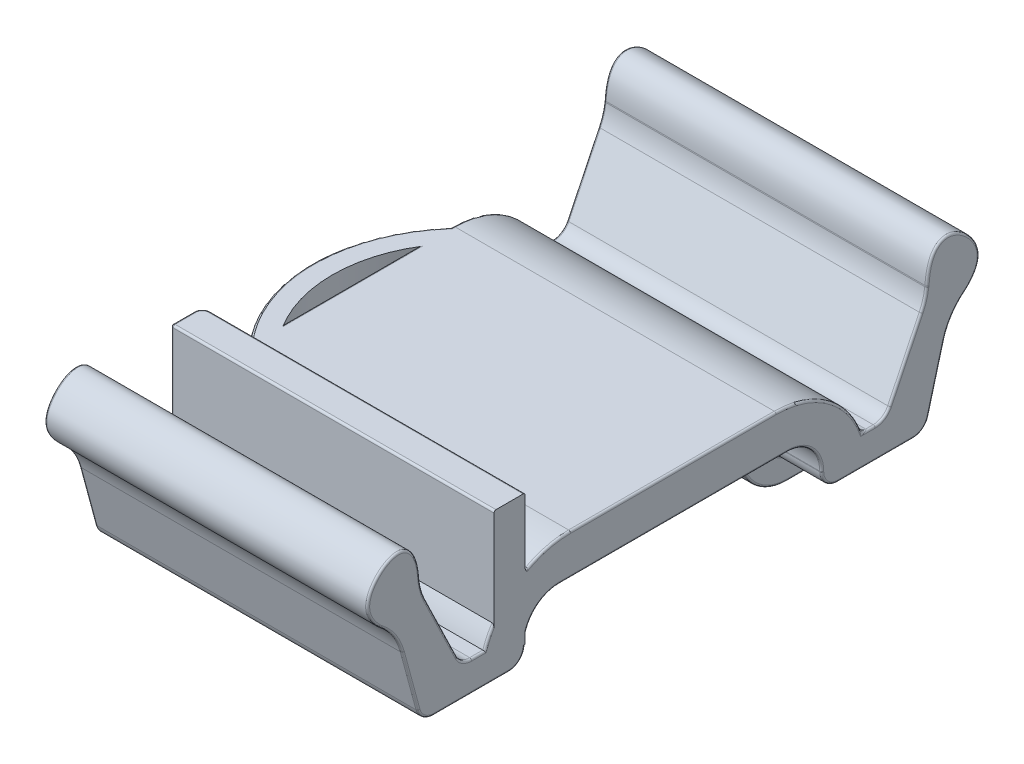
SolidWorks part; units mm, degrees
ref_plane "Front Plane" through (0, 0, 0) normal (0, 0, 1) x (1, 0, 0)
ref_plane "Top Plane" through (0, 0, 0) normal (0, 1, 0) x (1, 0, 0)
ref_plane "Right Plane" through (0, 0, 0) normal (1, 0, 0) x (0, 0, -1)
imported_body "Imported3"
draft "Draft1" type of draft neutral plane draft angle 3.658 faces to draft 1 parameters "D1"=3.658
